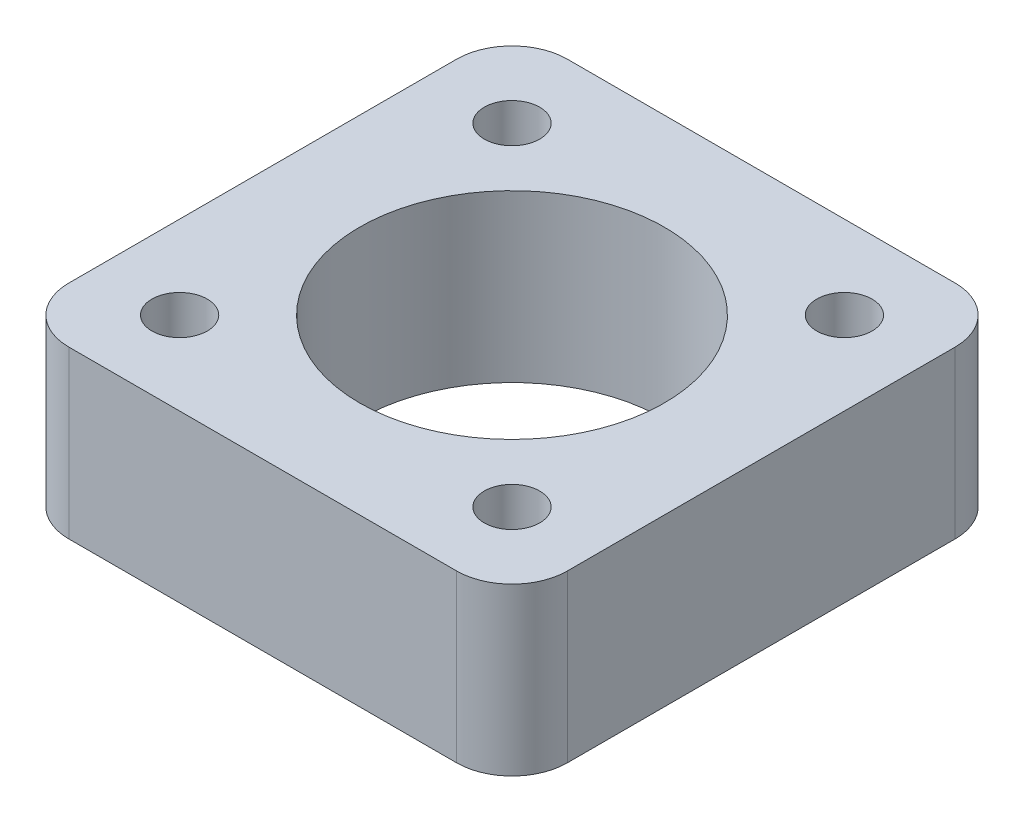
SolidWorks part; units mm, degrees
ref_plane "Front" through (0, 0, 0) normal (0, 0, 1) x (1, 0, 0)
ref_plane "Top" through (0, 0, 0) normal (0, 1, 0) x (1, 0, 0)
ref_plane "Right" through (0, 0, 0) normal (1, 0, 0) x (0, 0, -1)
sketch "Sketch1" plane through (0, 0, 0) normal (0, 1, 0) x (1, 0, 0)
  line L1 (0, 0) -> (36, 0)
  line L2 (0, 0) -> (0, 36)
  line L3 (0, 36) -> (36, 36)
  line L4 (36, 0) -> (36, 36)
  dimension "D1" = 36
extrude "Base-Extrude" add sketch "Sketch1" along normal blind 12
sketch "Sketch2" plane through (0, 12, 0) normal (0, 1, 0) x (-1, 0, 0)
  line L0 (0, 0) -> (-36, 0) construction
  line L3 (0, 0) -> (-36, -36) construction
  circle A0 centre (-18, -18) radius 11
  dimension "D1" = 22
extrude "center hole" cut sketch "Sketch2" against normal through all
sketch "Sketch3" plane through (0, 12, 0) normal (0, 1, 0) x (-1, 0, 0)
  line L0 (0, -36) -> (-36, 0) construction
  circle A0 centre (-6, -30) radius 2
  point P6 (-18, -18)
  dimension "D1" = 4
  dimension "D2" = 12
extrude "mounting hole" cut sketch "Sketch3" against normal through all
pattern_linear "LPattern1" count 2 spacing 24 count 2 spacing 24
fillet "Fillet1" radius 4
